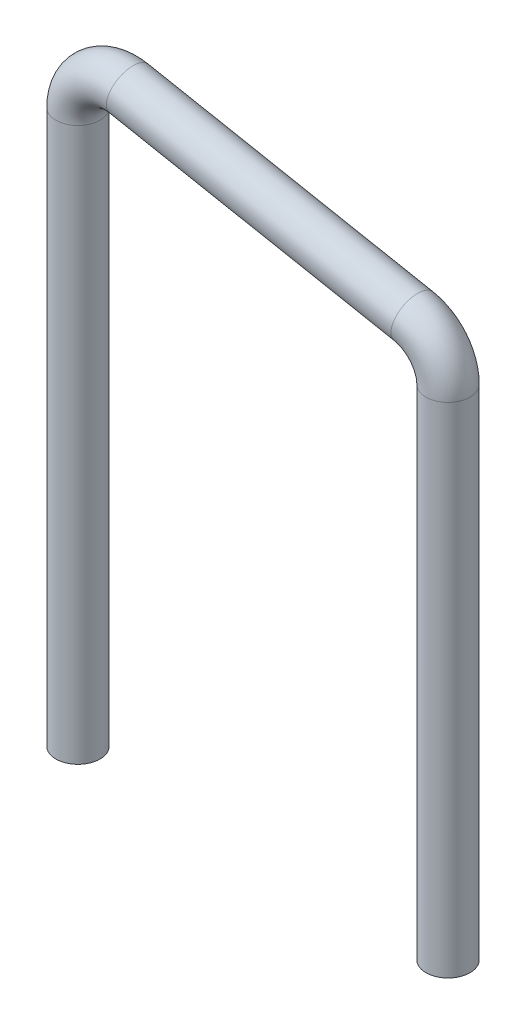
SolidWorks part; units mm, degrees
ref_plane "Plan1" through (0, 0, 0) normal (0, 0, 1) x (1, 0, 0)
ref_plane "Plan2" through (0, 0, 0) normal (0, 1, 0) x (1, 0, 0)
ref_plane "Plan3" through (0, 0, 0) normal (1, 0, 0) x (0, 0, -1)
sketch "Esquisse1" plane through (0, 0, 0) normal (0, 0, 1) x (1, 0, 0)
  line L0 (0, 0) -> (0, 70.0439)
  line L1 (-4.8669, 75.9359) -> (-44.8669, 83.6283)
  line L2 (-52, 77.7362) -> (-52, 0)
  arc A0 (0, 70.0439) -> (-4.8669, 75.9359) centre (-6, 70.0439) ccw
  arc A1 (-52, 77.7362) -> (-44.8669, 83.6283) centre (-46, 77.7362) cw
  point P6 (0, 75)
  point P10 (-52, 85)
  dimension "D4" = 6
  dimension "D1" = 52
  dimension "D2" = 85
  dimension "D3" = 75
sketch "Esquisse2" plane through (0, 0, 0) normal (0, 1, 0) x (1, 0, 0)
  circle A0 centre (0, 0) radius 3.1
  dimension "D1" = 6.2
sweep "Balayage1" add profiles "Esquisse2" path "Esquisse1"
